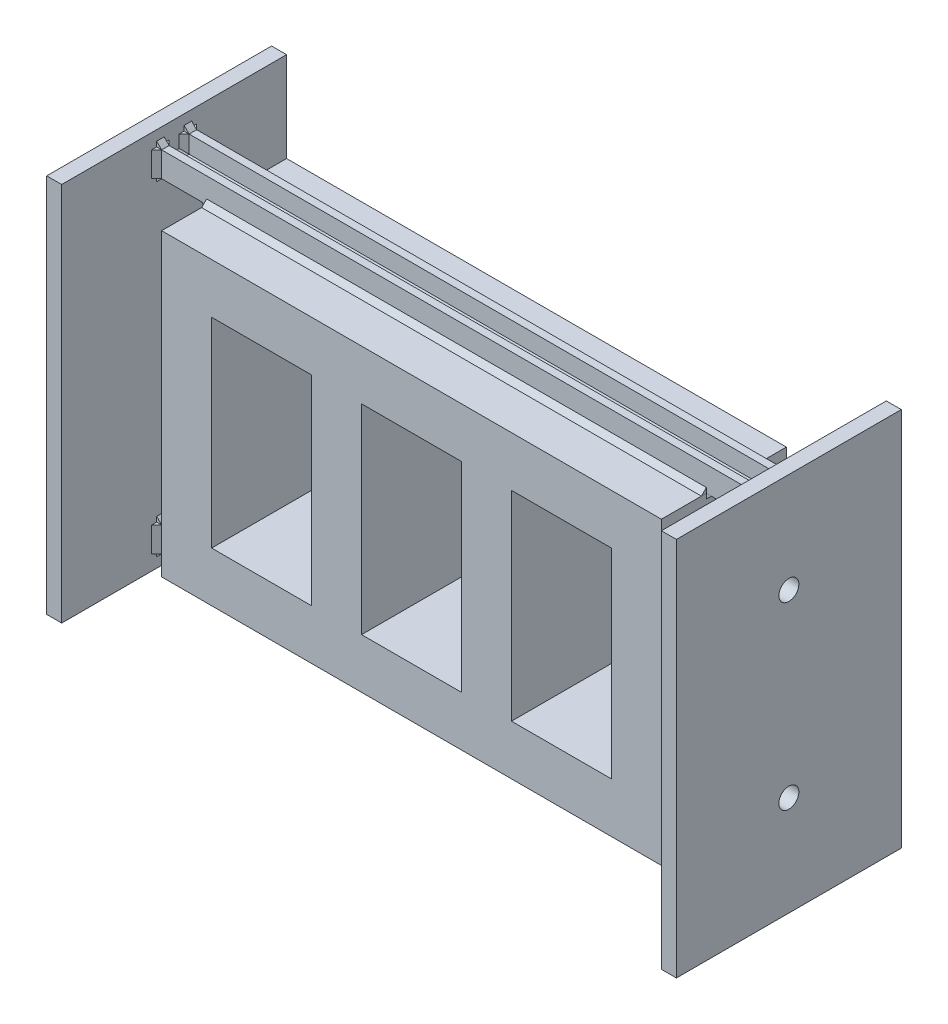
SolidWorks part; units mm, degrees
ref_plane "Front Plane" through (0, 0, 0) normal (0, 0, 1) x (1, 0, 0)
ref_plane "Top Plane" through (0, 0, 0) normal (0, 1, 0) x (1, 0, 0)
ref_plane "Right Plane" through (0, 0, 0) normal (1, 0, 0) x (0, 0, -1)
sketch "Sketch1" plane through (0, 0, 0) normal (0, 0, 1) x (1, 0, 0)
  line L1 (0, 0) -> (100, 0)
  line L2 (0, 0) -> (0, 60)
  line L3 (0, 60) -> (100, 60)
  line L4 (100, 0) -> (100, 60)
  dimension "D1" = 100
  dimension "D2" = 60
extrude "Boss-Extrude1" add sketch "Sketch1" along normal blind 25
sketch "Sketch2" plane through (0, 0, 25) normal (0, 0, 1) x (1, 0, 0)
  line L0 (0, 60) -> (0, 0) construction
  line L1 (10, 50) -> (30, 50)
  line L2 (10, 50) -> (10, 10)
  line L3 (10, 10) -> (30, 10)
  line L4 (30, 50) -> (30, 10)
  line L5 (0, 0) -> (100, 0) construction
  dimension "D1" = 10
  dimension "D2" = 20
  dimension "D3" = 40
  dimension "D4" = 10
extrude "Cut-Extrude1" cut sketch "Sketch2" against normal blind 40
pattern_linear "LPattern1" count 3 spacing 30 along (1, 0, 0) of "Cut-Extrude1"
sketch "Sketch3" plane through (0, 0, 0) normal (0, -1, 0) x (1, 0, 0)
  line L0 (0, 25) -> (0, 0) construction
  line L1 (-10, 9) -> (110, 9)
  line L2 (-10, 9) -> (-10, 16)
  line L3 (-10, 16) -> (110, 16)
  line L4 (110, 9) -> (110, 16)
  line L5 (100, 25) -> (100, 0) construction
  line L6 (0, 25) -> (100, 25) construction
  line L7 (0, 0) -> (100, 0) construction
  dimension "D1" = 10
  dimension "D2" = 10
  dimension "D3" = 9
  dimension "D4" = 9
extrude "Boss-Extrude2" add sketch "Sketch3" along normal blind 5
ref_plane "Plane1" through (0, 30, 0) normal (0, 1, 0) x (-1, 0, 0)
mirror "Mirror1" about plane through (0, 30, 0) normal (0, 1, 0) of "Boss-Extrude2"
sketch "Sketch4" plane through (-10, 0, 0) normal (-1, 0, 0) x (0, 0, 1)
  line L0 (16, -5) -> (9, -5) construction
  line L1 (10.5, -5) -> (14.5, -5)
  line L2 (10.5, -5) -> (10.5, -1.5)
  line L3 (10.5, -1.5) -> (14.5, -1.5)
  line L4 (14.5, -5) -> (14.5, -1.5)
  line L5 (9, -5) -> (9, 0) construction
  line L6 (16, -5) -> (16, 0) construction
  line L7 (16, 0) -> (9, 0) construction
  dimension "D1" = 1.5
  dimension "D2" = 1.5
  dimension "D3" = 1.5
extrude "Cut-Extrude2" cut sketch "Sketch4" against normal blind 151
mirror "Mirror2" about plane through (0, 30, 0) normal (0, 1, 0) of "Cut-Extrude2"
sketch "Sketch5" plane through (-10, 0, 0) normal (-1, 0, 0) x (0, 0, 1)
  line L0 (10.5, 65) -> (9, 65) construction
  line L1 (-10, -8) -> (35, -8)
  line L2 (-10, -8) -> (-10, 68)
  line L3 (-10, 68) -> (35, 68)
  line L4 (35, -8) -> (35, 68)
  line L5 (10.5, -5) -> (9, -5) construction
  line L6 (0, 60) -> (0, 0) construction
  line L7 (25, 60) -> (25, 0) construction
  dimension "D1" = 3
  dimension "D2" = 3
  dimension "D3" = 10
  dimension "D4" = 10
extrude "Boss-Extrude3" add sketch "Sketch5" along normal blind 3
ref_plane "Plane2" through (50, 0, 0) normal (1, 0, 0) x (0, 0, -1)
mirror "Mirror3" about plane through (50, 0, 0) normal (1, 0, 0) of "Boss-Extrude3"
sketch "Sketch7" plane through (110, 0, 0) normal (-1, 0, 0) x (0, 0, 1)
  line L0 (-10, 68) -> (-10, -8) construction
  line L1 (35, 68) -> (-10, 68) construction
  circle A0 centre (12.5, 48) radius 2
  dimension "D1" = 4
  dimension "D2" = 22.5
  dimension "D3" = 20
extrude "Cut-Extrude3" cut sketch "Sketch7" against normal blind 3
pattern_linear "LPattern2" count 2 spacing 36 along (0, -1, 0) of "Cut-Extrude3"
mirror "Mirror4" about plane through (50, 0, 0) normal (1, 0, 0) of "LPattern2", "Cut-Extrude3"
other "Gusset1" parameters "D1"=5, "D2"=5, "D3"=0, "D4"=0, "D10"=5, "D11"=1, "D12"=1, "D13"=15, "D14"=45, "D15"=15
sketch "Sketch8" plane through (110, -5, 9) normal (0, 1, 0) x (-1, 0, 0)
  line L0 (0, 0) -> (0, -1)
  line L1 (0, 0) -> (1, 0)
  line L2 (0, -1) -> (1, 0)
other "Gusset2" parameters "D1"=1.5, "D2"=1.5, "D3"=0, "D4"=0, "D10"=5, "D11"=1, "D12"=1, "D13"=15, "D14"=45, "D15"=15
sketch "Sketch9" plane through (110, -5, 10.5) normal (0, 0, -1) x (-1, 0, 0)
  line L0 (0, 0) -> (0, -1)
  line L1 (0, 0) -> (1, 0)
  line L2 (0, -1) -> (1, 0)
other "Gusset3" parameters "D1"=1.5, "D2"=1.5, "D3"=0, "D4"=0, "D10"=5, "D11"=1, "D12"=1, "D13"=15, "D14"=45, "D15"=15
sketch "Sketch10" plane through (110, -5, 14.5) normal (0, 0, 1) x (1, 0, 0)
  line L0 (0, 0) -> (-1, 0)
  line L1 (0, 0) -> (0, -1)
  line L2 (-1, 0) -> (0, -1)
other "Gusset4" parameters "D1"=4, "D2"=4, "D3"=0, "D4"=0, "D10"=5, "D11"=1, "D12"=1, "D13"=15, "D14"=45, "D15"=15
sketch "Sketch11" plane through (110, -1.5, 10.5) normal (0, 0, 1) x (1, 0, 0)
  line L0 (0, 0) -> (-1, 0)
  line L1 (0, 0) -> (0, -1)
  line L2 (-1, 0) -> (0, -1)
other "Gusset5" parameters "D1"=4, "D2"=4, "D3"=0, "D4"=0, "D10"=5, "D11"=1, "D12"=1, "D13"=15, "D14"=45, "D15"=15
sketch "Sketch12" plane through (110, -5, 10.5) normal (0, 1, 0) x (-1, 0, 0)
  line L0 (0, 0) -> (1, 0)
  line L1 (0, 0) -> (0, 1)
  line L2 (1, 0) -> (0, 1)
other "Gusset6" parameters "D1"=3.5, "D2"=4, "D3"=0, "D4"=0, "D10"=5, "D11"=1, "D12"=1, "D13"=15, "D14"=45, "D15"=15, "D16"=0.5, "D17"=0.5, "D18"=45
sketch "Sketch13" plane through (110, -1.5, 14.5) normal (0, -1, 0) x (1, 0, 0)
  line L0 (0, 0) -> (-1, 0)
  line L1 (0, 0) -> (0, -1)
  line L2 (-1, 0) -> (0, -1)
other "Gusset7" parameters "D1"=5, "D2"=5, "D3"=0, "D4"=0, "D10"=5, "D11"=1, "D12"=1, "D13"=15, "D14"=45, "D15"=15
sketch "Sketch14" plane through (110, -5, 16) normal (0, 1, 0) x (-1, 0, 0)
  line L0 (0, 0) -> (1, 0)
  line L1 (0, 0) -> (0, 1)
  line L2 (1, 0) -> (0, 1)
other "Gusset8" parameters "D1"=7, "D2"=7, "D3"=0, "D4"=0, "D10"=5, "D11"=1, "D12"=1, "D13"=15, "D14"=45, "D15"=15
sketch "Sketch15" plane through (110, 0, 16) normal (0, 0, -1) x (-1, 0, 0)
  line L0 (0, 0) -> (1, 0)
  line L1 (0, 0) -> (0, 1)
  line L2 (1, 0) -> (0, 1)
other "Gusset9" parameters "D1"=100, "D2"=100, "D3"=0, "D4"=0, "D10"=5, "D11"=1, "D12"=1, "D13"=15, "D14"=45, "D15"=15
sketch "Sketch16" plane through (100, 0, 9) normal (-1, 0, 0) x (0, 0, 1)
  line L0 (0, 0) -> (-1, 0)
  line L1 (0, 0) -> (0, -1)
  line L2 (-1, 0) -> (0, -1)
other "Gusset10" parameters "D1"=100, "D2"=100, "D3"=0, "D4"=0, "D10"=5, "D11"=1, "D12"=1, "D13"=15, "D14"=45, "D15"=15
sketch "Sketch17" plane through (100, 0, 16) normal (-1, 0, 0) x (0, 0, 1)
  line L0 (0, 0) -> (0, -1)
  line L1 (0, 0) -> (1, 0)
  line L2 (0, -1) -> (1, 0)
other "Gusset11" parameters "D1"=100, "D2"=100, "D3"=0, "D4"=0, "D10"=5, "D11"=1, "D12"=1, "D13"=15, "D14"=45, "D15"=15
sketch "Sketch18" plane through (0, 60, 9) normal (1, 0, 0) x (0, 0, -1)
  line L0 (0, 0) -> (1, 0)
  line L1 (0, 0) -> (0, 1)
  line L2 (1, 0) -> (0, 1)
other "Gusset12" parameters "D1"=100, "D2"=100, "D3"=0, "D4"=0, "D10"=5, "D11"=1, "D12"=1, "D13"=15, "D14"=45, "D15"=15
sketch "Sketch19" plane through (0, 60, 16) normal (1, 0, 0) x (0, 0, -1)
  line L0 (0, 0) -> (0, 1)
  line L1 (0, 0) -> (-1, 0)
  line L2 (0, 1) -> (-1, 0)
other "Gusset13" parameters "D1"=7, "D2"=7, "D3"=0, "D4"=0, "D10"=5, "D11"=1, "D12"=1, "D13"=15, "D14"=45, "D15"=15
sketch "Sketch20" plane through (0, 60, 16) normal (0, 0, -1) x (-1, 0, 0)
  line L0 (0, 0) -> (0, -1)
  line L1 (0, 0) -> (1, 0)
  line L2 (0, -1) -> (1, 0)
other "Gusset14" parameters "D1"=7, "D2"=7, "D3"=0, "D4"=0, "D10"=5, "D11"=1, "D12"=1, "D13"=15, "D14"=45, "D15"=15
sketch "Sketch21" plane through (0, 0, 9) normal (0, 0, 1) x (1, 0, 0)
  line L0 (0, 0) -> (0, 1)
  line L1 (0, 0) -> (-1, 0)
  line L2 (0, 1) -> (-1, 0)
other "Gusset15" parameters "D1"=7, "D2"=7, "D3"=0, "D4"=0, "D10"=5, "D11"=1, "D12"=1, "D13"=15, "D14"=45, "D15"=15
sketch "Sketch22" plane through (100, 0, 9) normal (0, 0, 1) x (1, 0, 0)
  line L0 (0, 0) -> (1, 0)
  line L1 (0, 0) -> (0, 1)
  line L2 (1, 0) -> (0, 1)
other "Gusset16" parameters "D1"=7, "D2"=7, "D3"=0, "D4"=0, "D10"=5, "D11"=1, "D12"=1, "D13"=15, "D14"=45, "D15"=15
sketch "Sketch23" plane through (100, 60, 16) normal (0, 0, -1) x (-1, 0, 0)
  line L0 (0, 0) -> (-1, 0)
  line L1 (0, 0) -> (0, -1)
  line L2 (-1, 0) -> (0, -1)
other "Gusset17" parameters "D1"=7, "D2"=7, "D3"=0, "D4"=0, "D10"=5, "D11"=1, "D12"=1, "D13"=15, "D14"=45, "D15"=15
sketch "Sketch24" plane through (110, 60, 9) normal (0, 0, 1) x (1, 0, 0)
  line L0 (0, 0) -> (-1, 0)
  line L1 (0, 0) -> (0, -1)
  line L2 (-1, 0) -> (0, -1)
other "Gusset18" parameters "D1"=7, "D2"=7, "D3"=0, "D4"=0, "D10"=5, "D11"=1, "D12"=1, "D13"=15, "D14"=45, "D15"=15
sketch "Sketch25" plane through (-10, 60, 9) normal (0, 0, 1) x (1, 0, 0)
  line L0 (0, 0) -> (0, -1)
  line L1 (0, 0) -> (1, 0)
  line L2 (0, -1) -> (1, 0)
other "Gusset19" parameters "D1"=7, "D2"=7, "D3"=0, "D4"=0, "D10"=5, "D11"=1, "D12"=1, "D13"=15, "D14"=45, "D15"=15
sketch "Sketch26" plane through (-10, 0, 16) normal (0, 0, -1) x (-1, 0, 0)
  line L0 (0, 0) -> (0, 1)
  line L1 (0, 0) -> (-1, 0)
  line L2 (0, 1) -> (-1, 0)
other "Gusset20" parameters "D1"=5, "D2"=5, "D3"=0, "D4"=0, "D10"=5, "D11"=1, "D12"=1, "D13"=15, "D14"=45, "D15"=15
sketch "Sketch27" plane through (-10, 60, 9) normal (0, 1, 0) x (-1, 0, 0)
  line L0 (0, 0) -> (-1, 0)
  line L1 (0, 0) -> (0, -1)
  line L2 (-1, 0) -> (0, -1)
other "Gusset21" parameters "D1"=5, "D2"=5, "D3"=0, "D4"=0, "D10"=5, "D11"=1, "D12"=1, "D13"=15, "D14"=45, "D15"=15
sketch "Sketch28" plane through (-10, -5, 9) normal (0, 1, 0) x (-1, 0, 0)
  line L0 (0, 0) -> (-1, 0)
  line L1 (0, 0) -> (0, -1)
  line L2 (-1, 0) -> (0, -1)
other "Gusset22" parameters "D1"=5, "D2"=5, "D3"=0, "D4"=0, "D10"=5, "D11"=1, "D12"=1, "D13"=15, "D14"=45, "D15"=15
sketch "Sketch29" plane through (110, 65, 9) normal (0, -1, 0) x (1, 0, 0)
  line L0 (0, 0) -> (-1, 0)
  line L1 (0, 0) -> (0, -1)
  line L2 (-1, 0) -> (0, -1)
other "Gusset23" parameters "D1"=5, "D2"=5, "D3"=0, "D4"=0, "D10"=5, "D11"=1, "D12"=1, "D13"=15, "D14"=45, "D15"=15
sketch "Sketch30" plane through (110, 65, 16) normal (0, -1, 0) x (1, 0, 0)
  line L0 (0, 0) -> (0, 1)
  line L1 (0, 0) -> (-1, 0)
  line L2 (0, 1) -> (-1, 0)
other "Gusset24" parameters "D1"=5, "D2"=5, "D3"=0, "D4"=0, "D10"=5, "D11"=1, "D12"=1, "D13"=15, "D14"=45, "D15"=15
sketch "Sketch31" plane through (-10, 0, 16) normal (0, -1, 0) x (1, 0, 0)
  line L0 (0, 0) -> (1, 0)
  line L1 (0, 0) -> (0, 1)
  line L2 (1, 0) -> (0, 1)
other "Gusset25" parameters "D1"=5, "D2"=5, "D3"=0, "D4"=0, "D10"=5, "D11"=1, "D12"=1, "D13"=15, "D14"=45, "D15"=15
sketch "Sketch32" plane through (-10, 65, 16) normal (0, -1, 0) x (1, 0, 0)
  line L0 (0, 0) -> (1, 0)
  line L1 (0, 0) -> (0, 1)
  line L2 (1, 0) -> (0, 1)
other "Gusset26" parameters "D1"=5, "D2"=5, "D3"=0, "D4"=0, "D10"=5, "D11"=1, "D12"=1, "D13"=15, "D14"=45, "D15"=15
sketch "Sketch33" plane through (110, 65, 14.5) normal (0, -1, 0) x (1, 0, 0)
  line L0 (0, 0) -> (-1, 0)
  line L1 (0, 0) -> (0, -1)
  line L2 (-1, 0) -> (0, -1)
other "Gusset27" parameters "D1"=5, "D2"=5, "D3"=0, "D4"=0, "D10"=5, "D11"=1, "D12"=1, "D13"=15, "D14"=45, "D15"=15
sketch "Sketch34" plane through (110, 61.5, 14.5) normal (0, 0, -1) x (-1, 0, 0)
  line L0 (0, 0) -> (1, 0)
  line L1 (0, 0) -> (0, 1)
  line L2 (1, 0) -> (0, 1)
other "Gusset28" parameters "D1"=3.5, "D2"=3.5, "D3"=0, "D4"=0, "D10"=5, "D11"=1, "D12"=1, "D13"=15, "D14"=45, "D15"=15
sketch "Sketch35" plane through (110, 61.5, 10.5) normal (0, 1, 0) x (-1, 0, 0)
  line L0 (0, 0) -> (1, 0)
  line L1 (0, 0) -> (0, 1)
  line L2 (1, 0) -> (0, 1)
other "Gusset29" parameters "D1"=3.5, "D2"=3.5, "D3"=0, "D4"=0, "D10"=5, "D11"=1, "D12"=1, "D13"=15, "D14"=45, "D15"=15
sketch "Sketch36" plane through (-10, 61.5, 14.5) normal (0, 1, 0) x (-1, 0, 0)
  line L0 (0, 0) -> (-1, 0)
  line L1 (0, 0) -> (0, -1)
  line L2 (-1, 0) -> (0, -1)
other "Gusset30" parameters "D1"=3.5, "D2"=3.5, "D3"=0, "D4"=0, "D10"=5, "D11"=1, "D12"=1, "D13"=15, "D14"=45, "D15"=15
sketch "Sketch37" plane through (-10, 65, 10.5) normal (0, -1, 0) x (1, 0, 0)
  line L0 (0, 0) -> (1, 0)
  line L1 (0, 0) -> (0, 1)
  line L2 (1, 0) -> (0, 1)
other "Gusset31" parameters "D1"=3.5, "D2"=3.5, "D3"=0, "D4"=0, "D10"=5, "D11"=1, "D12"=1, "D13"=15, "D14"=45, "D15"=15
sketch "Sketch38" plane through (-10, -1.5, 14.5) normal (0, -1, 0) x (1, 0, 0)
  line L0 (0, 0) -> (0, -1)
  line L1 (0, 0) -> (1, 0)
  line L2 (0, -1) -> (1, 0)
other "Gusset32" parameters "D1"=3.5, "D2"=3.5, "D3"=0, "D4"=0, "D10"=5, "D11"=1, "D12"=1, "D13"=15, "D14"=45, "D15"=15
sketch "Sketch39" plane through (-10, -1.5, 10.5) normal (0, -1, 0) x (1, 0, 0)
  line L0 (0, 0) -> (1, 0)
  line L1 (0, 0) -> (0, 1)
  line L2 (1, 0) -> (0, 1)
other "Gusset33" parameters "D1"=4, "D2"=4, "D3"=0, "D4"=0, "D10"=5, "D11"=1, "D12"=1, "D13"=15, "D14"=45, "D15"=15
sketch "Sketch40" plane through (-10, -1.5, 14.5) normal (0, 0, -1) x (-1, 0, 0)
  line L0 (0, 0) -> (-1, 0)
  line L1 (0, 0) -> (0, -1)
  line L2 (-1, 0) -> (0, -1)
other "Gusset34" parameters "D1"=4, "D2"=4, "D3"=0, "D4"=0, "D10"=5, "D11"=1, "D12"=1, "D13"=15, "D14"=45, "D15"=15
sketch "Sketch41" plane through (-10, 61.5, 10.5) normal (0, 0, 1) x (1, 0, 0)
  line L0 (0, 0) -> (1, 0)
  line L1 (0, 0) -> (0, 1)
  line L2 (1, 0) -> (0, 1)
other "Gusset35" parameters "D1"=1.5, "D2"=1.5, "D3"=0, "D4"=0, "D10"=5, "D11"=1, "D12"=1, "D13"=15, "D14"=45, "D15"=15
sketch "Sketch42" plane through (-10, 65, 9) normal (0, 0, 1) x (1, 0, 0)
  line L0 (0, 0) -> (1, 0)
  line L1 (0, 0) -> (0, 1)
  line L2 (1, 0) -> (0, 1)
other "Gusset36" parameters "D1"=1.5, "D2"=1.5, "D3"=0, "D4"=0, "D10"=5, "D11"=1, "D12"=1, "D13"=15, "D14"=45, "D15"=15
sketch "Sketch43" plane through (-10, 65, 14.5) normal (0, 0, 1) x (1, 0, 0)
  line L0 (0, 0) -> (1, 0)
  line L1 (0, 0) -> (0, 1)
  line L2 (1, 0) -> (0, 1)
other "Gusset37" parameters "D1"=1.5, "D2"=1.5, "D3"=0, "D4"=0, "D10"=5, "D11"=1, "D12"=1, "D13"=15, "D14"=45, "D15"=15
sketch "Sketch44" plane through (110, 65, 10.5) normal (0, 0, -1) x (-1, 0, 0)
  line L0 (0, 0) -> (1, 0)
  line L1 (0, 0) -> (0, 1)
  line L2 (1, 0) -> (0, 1)
other "Gusset38" parameters "D1"=1.5, "D2"=1.5, "D3"=0, "D4"=0, "D10"=5, "D11"=1, "D12"=1, "D13"=15, "D14"=45, "D15"=15
sketch "Sketch45" plane through (110, 65, 16) normal (0, 0, -1) x (-1, 0, 0)
  line L0 (0, 0) -> (1, 0)
  line L1 (0, 0) -> (0, 1)
  line L2 (1, 0) -> (0, 1)
other "Gusset39" parameters "D1"=1.5, "D2"=1.5, "D3"=0, "D4"=0, "D10"=5, "D11"=1, "D12"=1, "D13"=15, "D14"=45, "D15"=15
sketch "Sketch46" plane through (-10, -5, 10.5) normal (0, 0, -1) x (-1, 0, 0)
  line L0 (0, 0) -> (-1, 0)
  line L1 (0, 0) -> (0, -1)
  line L2 (-1, 0) -> (0, -1)
other "Gusset40" parameters "D1"=1.5, "D2"=1.5, "D3"=0, "D4"=0, "D10"=5, "D11"=1, "D12"=1, "D13"=15, "D14"=45, "D15"=15
sketch "Sketch47" plane through (-10, -5, 16) normal (0, 0, -1) x (-1, 0, 0)
  line L0 (0, 0) -> (-1, 0)
  line L1 (0, 0) -> (0, -1)
  line L2 (-1, 0) -> (0, -1)
